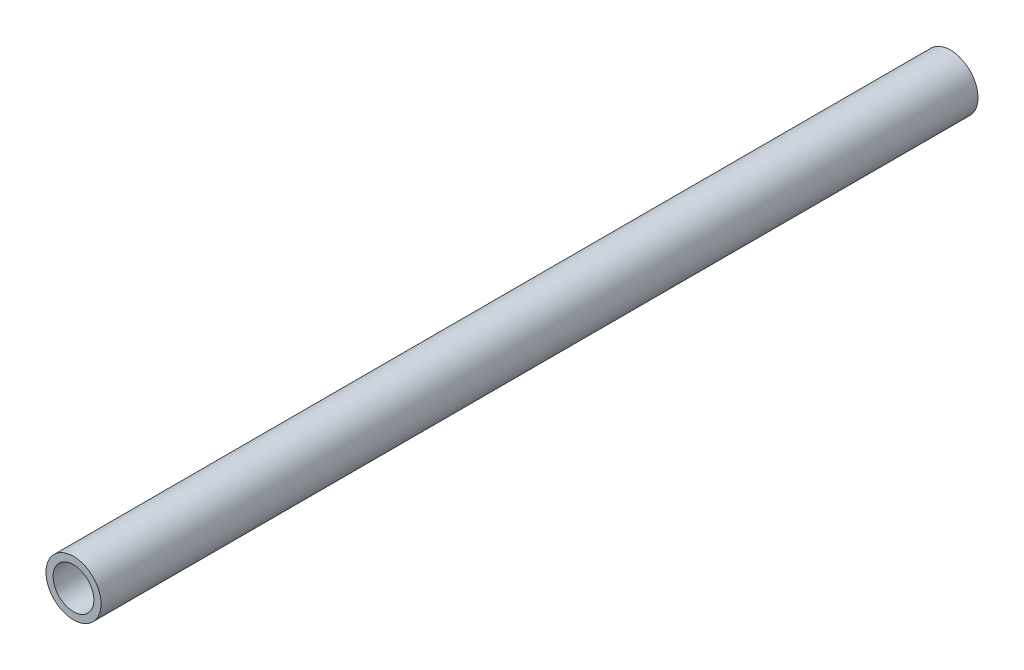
SolidWorks part; units mm, degrees
ref_plane "Front Plane" through (0, 0, 0) normal (0, 0, 1) x (1, 0, 0)
ref_plane "Top Plane" through (0, 0, 0) normal (0, 1, 0) x (1, 0, 0)
ref_plane "Right Plane" through (0, 0, 0) normal (1, 0, 0) x (0, 0, -1)
sketch "Sketch1" plane through (0, 0, 0) normal (0, 0, 1) x (1, 0, 0)
  circle A0 centre (0, 0) radius 8.5725
  circle A1 centre (0, 0) radius 6.35
  dimension "D1" = 17.145
  dimension "D2" = 12.7
extrude "Boss-Extrude1" add sketch "Sketch1" along normal blind 273.05
